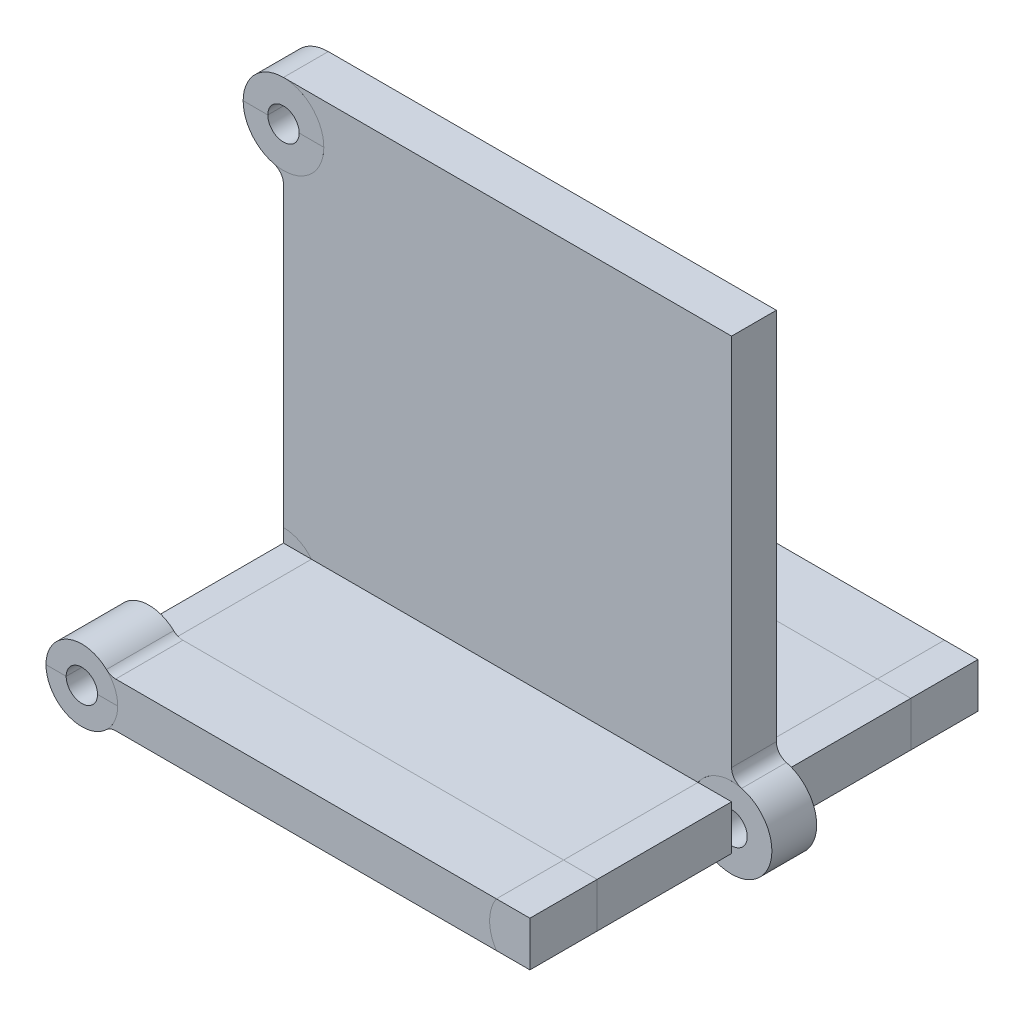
SolidWorks part; units mm, degrees
ref_plane "Front Plane" through (0, 0, 0) normal (0, 0, 1) x (1, 0, 0)
ref_plane "Top Plane" through (0, 0, 0) normal (0, 1, 0) x (1, 0, 0)
ref_plane "Right Plane" through (0, 0, 0) normal (1, 0, 0) x (0, 0, -1)
sketch "Sketch1" plane through (0, 0, 0) normal (0, 0, 1) x (1, 0, 0)
  line L1 (0, 0) -> (100, 0)
  line L2 (0, 0) -> (0, 10)
  line L3 (0, 10) -> (100, 10)
  line L4 (100, 0) -> (100, 10)
  dimension "D1" = 100
  dimension "D2" = 10
extrude "Boss-Extrude1" add sketch "Sketch1" along normal mid plane 100
ref_plane "Plane1" through (0, 0, 0) normal (0, 0, 1) x (1, 0, 0)
sketch "Sketch2" plane through (0, 0, 0) normal (0, 0, 1) x (1, 0, 0)
  line L1 (0, 10) -> (100, 10)
  line L2 (0, 10) -> (0, 100)
  line L3 (0, 100) -> (100, 100)
  line L4 (100, 10) -> (100, 100)
  dimension "D1" = 100
  dimension "D2" = 90
extrude "Boss-Extrude2" add sketch "Sketch2" along normal mid plane 10
sketch "Sketch3" plane through (0, 0, 50) normal (0, 0, 1) x (1, 0, 0)
  line L0 (0, 10) -> (0, 0) construction
  circle A0 centre (0, 5) radius 8
  dimension "D1" = 16
extrude "Boss-Extrude3" add sketch "Sketch3" against normal blind 15
mirror "Mirror1" about plane through (0, 0, 0) normal (0, 0, 1) of "Boss-Extrude3"
sketch "Sketch5" plane through (0, 0, 50) normal (0, 0, 1) x (1, 0, 0)
  circle A0 centre (0, 5) radius 3.5
  dimension "D1" = 7
extrude "Cut-Extrude1" cut sketch "Sketch5" against normal through all
sketch "Sketch6" plane through (0, 0, 5) normal (0, 0, 1) x (1, 0, 0)
  line L0 (0, 100) -> (0, 10) construction
  line L1 (100, 100) -> (0, 100) construction
  circle A0 centre (0, 91) radius 9
  dimension "D1" = 9
extrude "Boss-Extrude4" add sketch "Sketch6" against normal up to surface (10 mm away)
sketch "Sketch7" plane through (0, 0, 5) normal (0, 0, 1) x (1, 0, 0)
  circle A0 centre (0, 91) radius 3.5
  dimension "D1" = 7
extrude "Cut-Extrude2" cut sketch "Sketch7" against normal blind 27
sketch "Sketch8" plane through (0, 0, 5) normal (0, 0, 1) x (1, 0, 0)
  line L0 (100, 0) -> (100, 10) construction
  circle A0 centre (100, 5) radius 9
  dimension "D1" = 18
extrude "Boss-Extrude5" add sketch "Sketch8" against normal up to surface (10 mm away)
sketch "Sketch9" plane through (0, 0, 5) normal (0, 0, 1) x (1, 0, 0)
  line L0 (100, 0) -> (100, 10) construction
  circle A0 centre (100, 5) radius 3.5
  dimension "D1" = 7
extrude "Cut-Extrude3" cut sketch "Sketch9" against normal up to surface (10 mm away)
fillet "Fillet1" radius 3 1 edges at (0, 82, 0)
fillet "Fillet2" radius 3 6 edges at (6.245, 10, -42.5) (100, 14, 0) (92.5167, 0, 0) (6.245, 0, -42.5) (6.245, 0, 42.5) (6.245, 10, 42.5)
sketch "Sketch10" plane through (0, 0, 50) normal (0, 0, 1) x (1, 0, 0)
  circle A0 centre (0, 5) radius 8
  dimension "D1" = 16
split "Split1" trim tools "Sketch10" bodies to split 109 resulting bodies 110 111
sketch "Sketch11" plane through (0, 0, 5) normal (0, 0, 1) x (1, 0, 0)
  circle A0 centre (0, 91) radius 9
split "Split2" trim tools "Sketch11" bodies to split 111 110 resulting bodies 112 113 114
sketch "Sketch12" plane through (0, 0, 5) normal (0, 0, 1) x (1, 0, 0)
  line L0 (100, 0) -> (100, 10) construction
  circle A0 centre (100, 5) radius 9
split "Split3" trim tools "Sketch12" bodies to split 114 113 112 resulting bodies 115 116 117 118
sketch "Sketch13" plane through (0, 100, 0) normal (0, 1, 0) x (1, 0, 0)
  line L0 (-8, 35) -> (6.245, 35) construction
  line L1 (-20.8223, 5) -> (116.5888, 5)
  line L2 (-20.8223, 5) -> (-20.8223, 35)
  line L3 (-20.8223, 35) -> (116.5888, 35)
  line L4 (116.5888, 5) -> (116.5888, 35)
  line L5 (-18.3239, -5) -> (110.9345, -5)
  line L6 (-18.3239, -5) -> (-18.3239, -35)
  line L7 (-18.3239, -35) -> (110.9345, -35)
  line L8 (110.9345, -5) -> (110.9345, -35)
  line L9 (6.245, 5) -> (92.5167, 5) construction
  line L10 (0, -35) -> (-3.5, -35) construction
  line L11 (100, -5) -> (0, -5) construction
split "Split4" trim tools "Sketch13" bodies to split 117 118 116 115 resulting bodies 119 120 121 122 123 124 125 126 127 128 129 130 131 132 133 134
sketch "Sketch14" plane through (0, 0, 50) normal (0, 0, 1) x (1, 0, 0)
  line L0 (-8, 5) -> (8, 5)
  line L1 (-9, 91) -> (9, 91)
  arc A0 (-8, 5) -> (8, 5) centre (0, 5) ccw
  arc A1 (-9, 91) -> (9, 91) centre (0, 91) ccw
split "Split5" trim tools "Sketch14" bodies to split 134 127 123 125 121 130 128 133 126 122 119 131 129 124 120 132 resulting bodies 135 136 137 138 139 141 142 143 144 145 146 147 148 149 150 151 152 153 154 155 156
